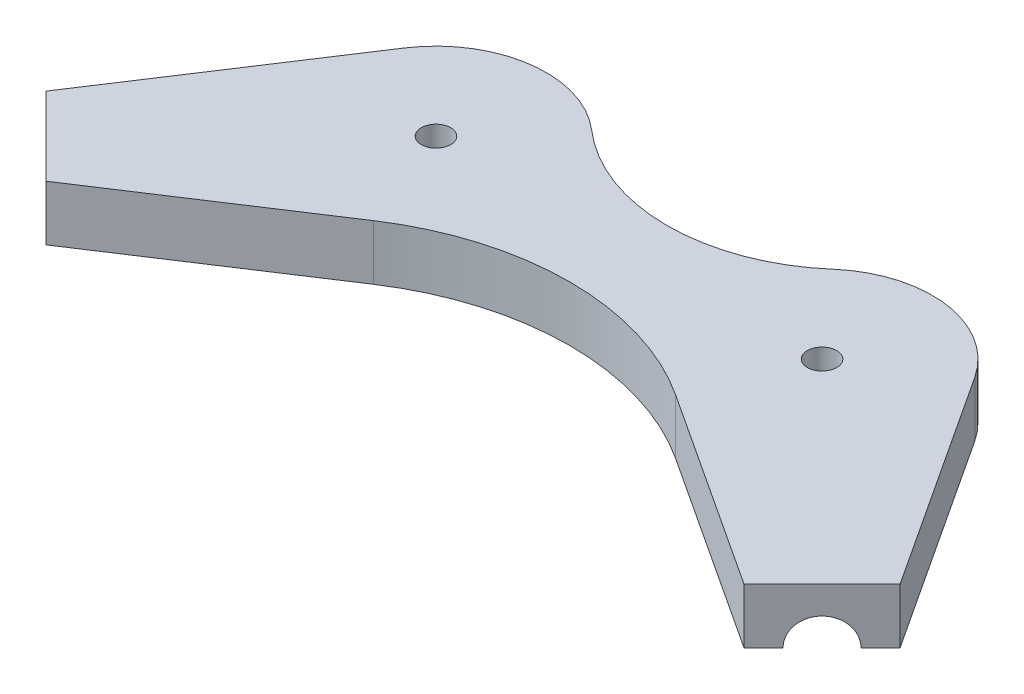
SolidWorks part; units mm, degrees
ref_plane "Alzado" through (0, 0, 0) normal (0, 0, 1) x (1, 0, 0)
ref_plane "Planta" through (0, 0, 0) normal (0, 1, 0) x (1, 0, 0)
ref_plane "Vista lateral" through (0, 0, 0) normal (1, 0, 0) x (0, 0, -1)
sketch "Croquis1" plane through (0, 0, 0) normal (0, 1, 0) x (1, 0, 0)
  line L0 (21419.2982, 4422.6237) -> (21398.085, 4443.8369)
  line L1 (21398.085, 4443.8369) -> (21436.6264, 4502.6974)
  line L2 (21419.2982, 4422.6237) -> (21473.1393, 4457.8785)
  line L3 (21609.151, 4422.6237) -> (21630.3642, 4443.8369)
  line L4 (21630.3642, 4443.8369) -> (21591.8228, 4502.6974)
  line L5 (21609.151, 4422.6237) -> (21555.3099, 4457.8785)
  circle A0 centre (21461.7246, 4486.2633) radius 4
  arc A1 (21481.4121, 4508.8996) -> (21436.6264, 4502.6974) centre (21461.7246, 4486.2633) ccw
  circle A2 centre (21566.7246, 4486.2633) radius 4
  arc A3 (21591.8228, 4502.6974) -> (21547.0371, 4508.8996) centre (21566.7246, 4486.2633) ccw
  arc A4 (21555.3099, 4457.8785) -> (21473.1393, 4457.8785) centre (21514.2246, 4395.1329) ccw
  arc A5 (21481.4121, 4508.8996) -> (21547.0371, 4508.8996) centre (21514.2246, 4546.6268) ccw
extrude "Saliente-Extruir1" add sketch "Croquis1" along normal blind 15
sketch "Croquis2" plane through (12920.961, 0, -12920.961) normal (-0.7071, 0, 0.7071) x (0.7071, 0, 0.7071)
  line L0 (11988.4638, 0) -> (12018.4638, 0) construction
  circle A0 centre (12003.4638, 0) radius 7.5
  dimension "D1" = 15
extrude "Cortar-Extruir1" cut sketch "Croquis2" against normal blind 30
sketch "Croquis3" plane through (8593.2637, 0, 8593.2637) normal (0.7071, 0, 0.7071) x (0.7071, 0, -0.7071)
  line L0 (18407.2444, 0) -> (18437.2444, 0) construction
  circle A0 centre (18422.2444, 0) radius 7.5
  dimension "D1" = 15
extrude "Cortar-Extruir2" cut sketch "Croquis3" against normal blind 30
